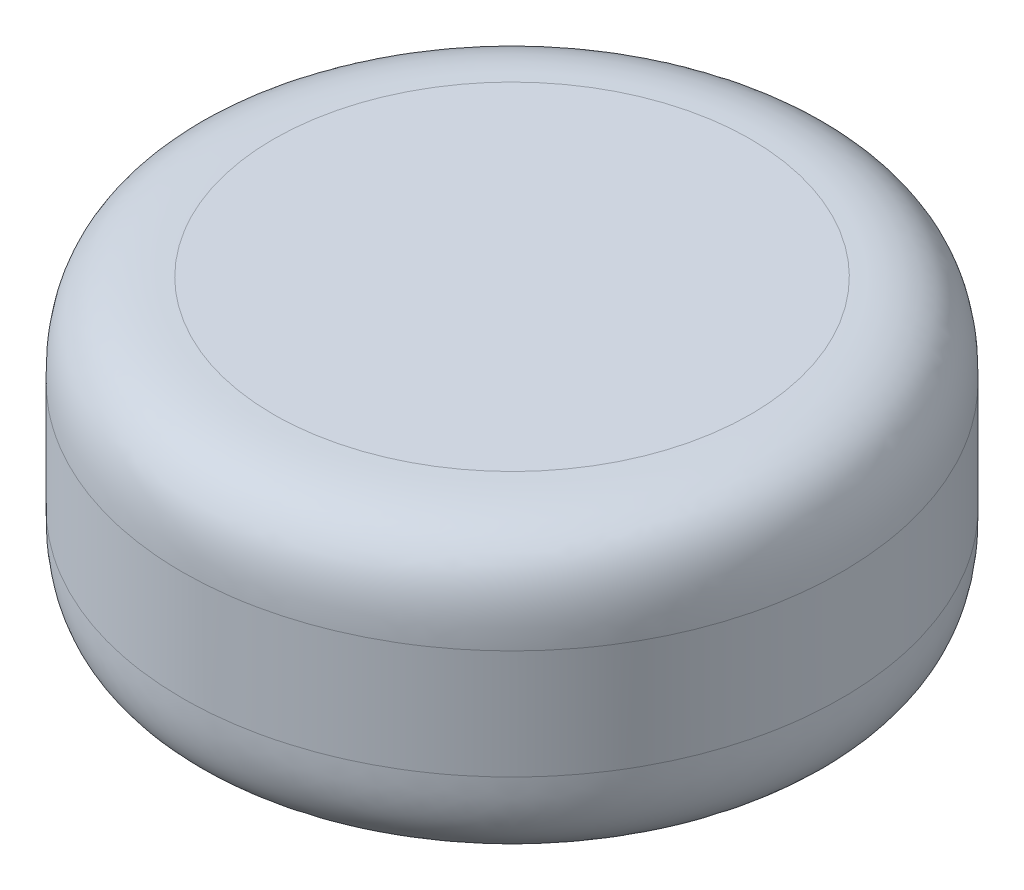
SolidWorks part; units mm, degrees
ref_plane "Frontal Plane" through (0, 0, 0) normal (0, 0, 1) x (1, 0, 0)
ref_plane "Horizontal Plane" through (0, 0, 0) normal (0, 1, 0) x (1, 0, 0)
ref_plane "Profile Plane" through (0, 0, 0) normal (1, 0, 0) x (0, 0, -1)
sketch "Sketch1" plane through (0, 0, 0) normal (0, 1, 0) x (1, 0, 0)
  circle A0 centre (0, 0) radius 4.5974
  dimension "D1" = 9.1948
extrude "Boss-Extrude1" add sketch "Sketch1" along normal blind 4.064
fillet "Fillet1" radius 1.27 1 edges at (0, 0, 4.5974)
fillet "Fillet3" radius 1.27 1 edges at (0, 4.064, 4.5974)
